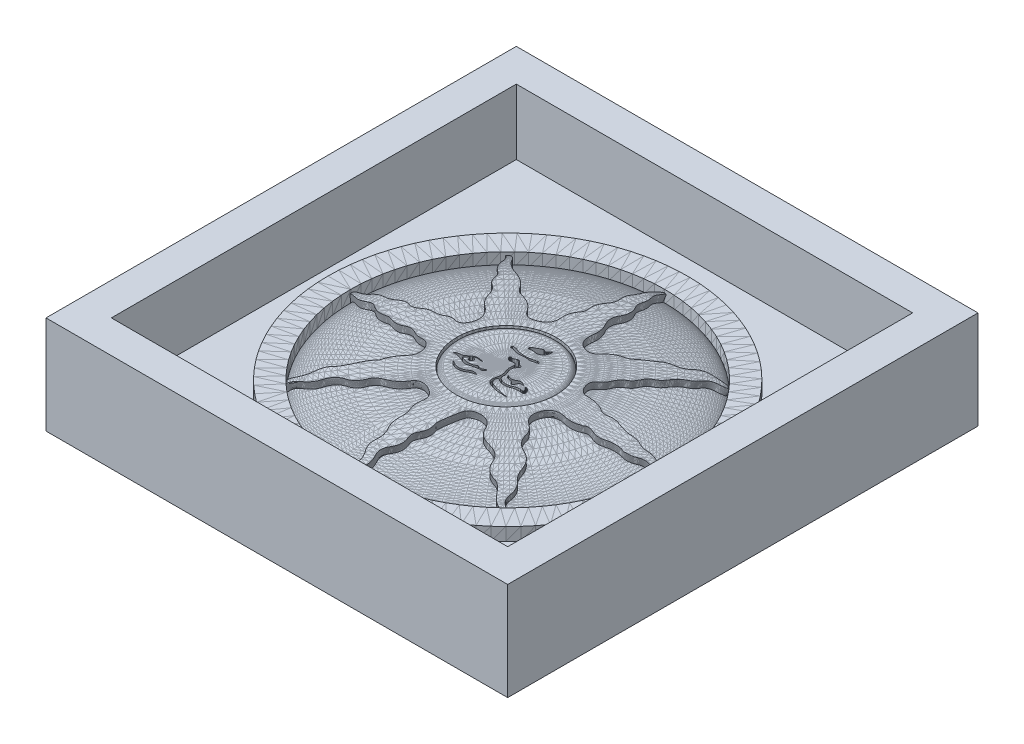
SolidWorks part; units mm, degrees
ref_plane "Alzado" through (0, 0, 0) normal (0, 0, 1) x (1, 0, 0)
ref_plane "Planta" through (0, 0, 0) normal (0, 1, 0) x (1, 0, 0)
ref_plane "Vista lateral" through (0, 0, 0) normal (1, 0, 0) x (0, 0, -1)
imported_body "Sólido importado1"
imported_body "Sólido importado2"
imported_body "Sólido importado3"
sketch "Croquis1" plane through (0, 0, 0) normal (0, 1, 0) x (1, 0, 0)
  line L1 (-155.527, 29.844) -> (-94.884, 29.844)
  line L2 (-155.527, 29.844) -> (-155.527, -32.122)
  line L3 (-155.527, -32.122) -> (-94.884, -32.122)
  line L4 (-94.884, 29.844) -> (-94.884, -32.122)
  line L5 (-160.527, 34.844) -> (-89.884, 34.844)
  line L6 (-160.527, 34.844) -> (-160.527, -37.122)
  line L7 (-160.527, -37.122) -> (-89.884, -37.122)
  line L8 (-89.884, 34.844) -> (-89.884, -37.122)
  dimension "D1" = 5
  dimension "D2" = 5
  dimension "D3" = 5
  dimension "D4" = 5
extrude "Saliente-Extruir1" add sketch "Croquis1" along normal blind 10
sketch "Croquis2" plane through (0, 0, 0) normal (0, -1, 0) x (1, 0, 0)
  line L1 (-160.527, 37.122) -> (-89.884, 37.122)
  line L2 (-160.527, 37.122) -> (-160.527, -34.844)
  line L3 (-160.527, -34.844) -> (-89.884, -34.844)
  line L4 (-89.884, 37.122) -> (-89.884, -34.844)
extrude "Saliente-Extruir2" add sketch "Croquis2" along normal blind 5
